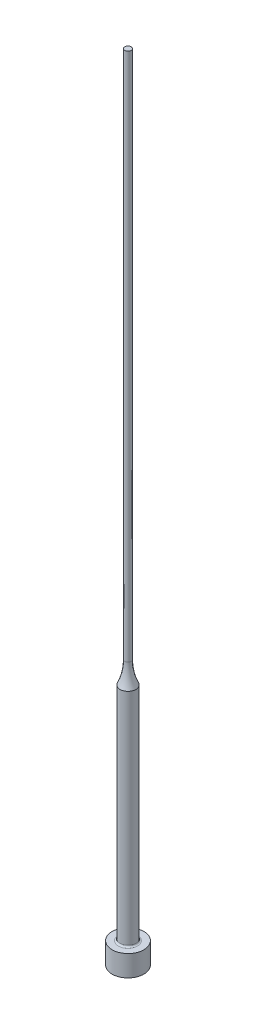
SolidWorks part; units mm, degrees
ref_plane "Front Plane" through (0, 0, 0) normal (0, 0, 1) x (1, 0, 0)
ref_plane "Top Plane" through (0, 0, 0) normal (0, 1, 0) x (1, 0, 0)
ref_plane "Right Plane" through (0, 0, 0) normal (1, 0, 0) x (0, 0, -1)
sketch "Sketch1" plane through (0, 0, 0) normal (0, 0, 1) x (1, 0, 0)
  line L0 (0, 0) -> (3, 0)
  line L1 (55, 0) -> (-55, 0) construction
  line L2 (3, 0) -> (3, 4)
  line L3 (3, 4) -> (1.8, 4)
  line L4 (1.5, 4.3) -> (1.5, 45.8539)
  line L6 (0.6, 50) -> (0.6, 150)
  line L7 (0.6, 150) -> (0, 150)
  line L8 (0, 150) -> (0, 0)
  arc A0 (0.6, 50) -> (1.5, 45.8539) centre (10.6, 50) ccw
  arc A1 (1.8, 4) -> (1.5, 4.3) centre (1.8, 4.3) cw
  dimension "D7" = 50
  dimension "D8" = 0.3
  dimension "D5" = 10
  dimension "D1" = 0.6
  dimension "D2" = 1.5
  dimension "D3" = 3
  dimension "D4" = 4
  dimension "D6" = 150
revolve "Revolve1" add sketch "Sketch1" angle 360 about L8
